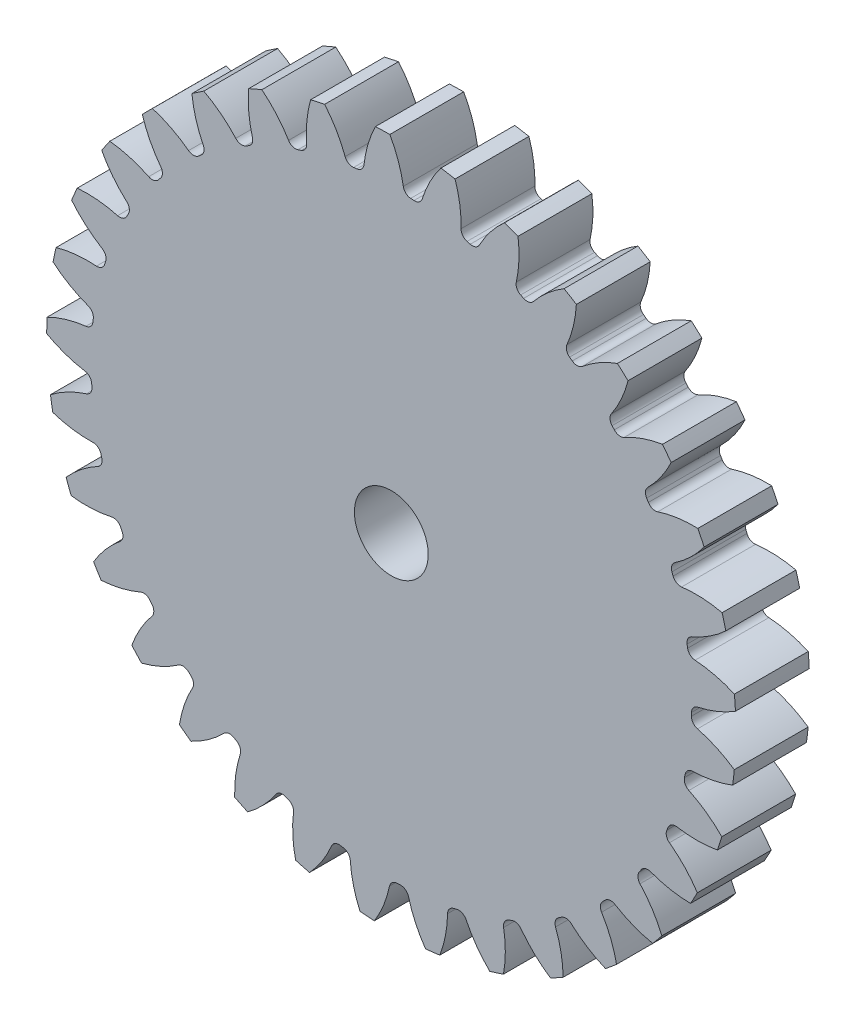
SolidWorks part; units mm, degrees
ref_plane "Front" through (0, 0, 0) normal (0, 0, 1) x (1, 0, 0)
ref_plane "Top" through (0, 0, 0) normal (0, 1, 0) x (1, 0, 0)
ref_plane "Right" through (0, 0, 0) normal (1, 0, 0) x (0, 0, -1)
sketch "Sketch3" plane through (0, 0, 0) normal (0, 0, 1) x (1, 0, 0)
  circle A0 centre (0, 0) radius 592.6667
  dimension "od" = 1185.3333
extrude "gearBody" add sketch "Sketch3" along normal blind 127
sketch "Sketch2" plane through (0, 0, 0) normal (0, 0, 1) x (1, 0, 0)
  line L0 (0, 0) -> (485.1294, 200.9472) construction
  line L1 (590.6663, -57.813) -> (0, 0) construction
  line L2 (0, 0) -> (36.3143, 0) construction
  line L3 (558.6258, 13.9534) -> (557.4356, -39.0258) construction
  line L5 (558.0307, -12.5362) -> (0, 0) construction
  line L7 (0, 0) -> (525.1002, 0) construction
  arc A0 (525.0847, 4.0412) -> (524.3735, -27.6173) centre (0, 0) ccw construction
  arc A1 (591.8696, 30.727) -> (589.8926, -57.2753) centre (0, 0) ccw construction
  arc A2 (558.6258, 13.9534) -> (557.4356, -39.0258) centre (0, 0) ccw construction
  arc A3 (516.2643, -14.455) -> (516.3926, -8.7436) centre (0, 0) ccw
  arc A4 (590.6663, -57.813) -> (526.5485, -28.1743) centre (475.6159, -222.5303) ccw
  arc A5 (590.6663, -57.813) -> (592.6667, 31.2294) centre (0, 0) ccw
  arc A6 (592.6667, 31.2294) -> (527.2826, 4.5) centre (485.1294, 200.9472) cw
  arc A7 (516.3926, -8.7436) -> (527.2826, 4.5) centre (530.1744, -8.977) cw
  arc A8 (526.5485, -28.1743) -> (516.2643, -14.455) centre (530.0427, -14.8408) cw
  point P6 (592.6667, 31.2294)
  point P22 (590.6663, -57.813)
  dimension "baseDia" = 1050.2005
  dimension "od" = 1185.3333
  dimension "pd" = 1117.6
  dimension "rd" = 1032.9333
  dimension "rFillet" = 13.7837
  dimension "pointX" = 592.6667
  dimension "pointY" = 31.2294
  dimension "CTT" = 52.9791
  dimension "flankCenterAngle" = 22.5
extrude "toothCut" cut sketch "Sketch2" along normal through all
pattern_circular "CirPattern1" count 33 over 360 about axis through (0, 0, 0) along (0, 0, 1) of "toothCut"
sketch "hub1Dia" plane through (0, 0, 0) normal (0, 0, -1) x (-1, 0, 0)
  circle A0 centre (0, 0) radius 12.7
  dimension "hub1Dia" = 25.4
sketch "hub2Dia" plane through (0, 0, 127) normal (0, 0, 1) x (1, 0, 0)
  circle A0 centre (0, 0) radius 12.7
  dimension "hub2dia" = 25.4
sketch "boreDia" plane through (0, 0, 0) normal (0, 0, 1) x (1, 0, 0)
  circle A0 centre (0, 0) radius 63.5
  dimension "boreDia" = 127
extrude "bore" cut sketch "boreDia" against normal mid plane 25400
